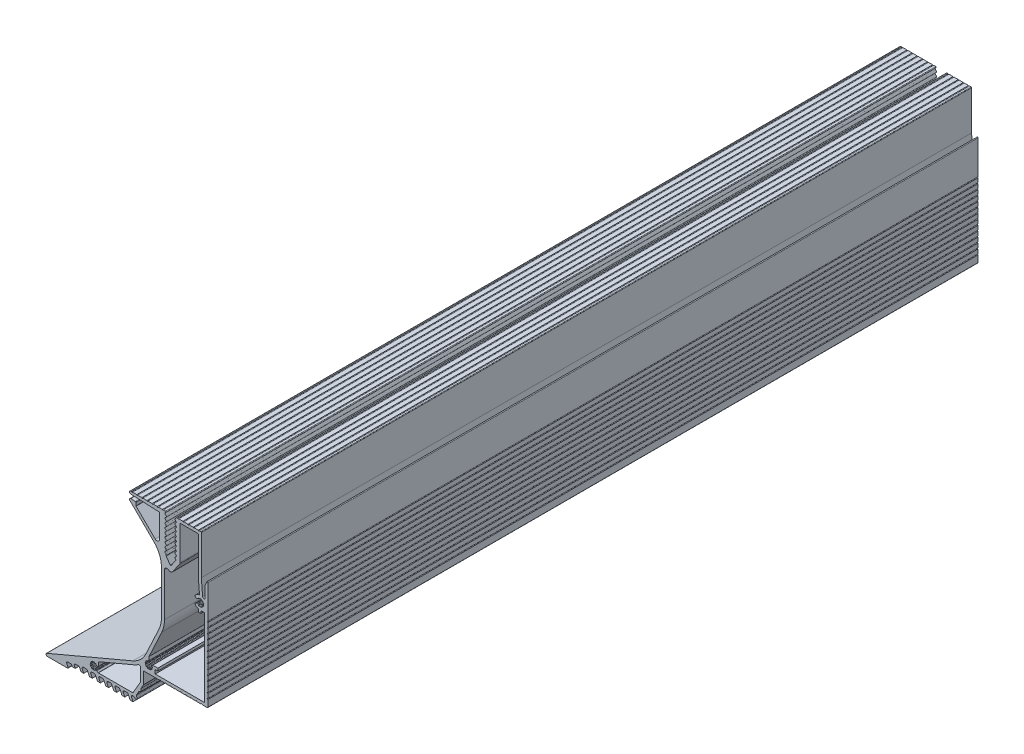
SolidWorks part; units mm, degrees
ref_plane "Спереди" through (0, 0, 0) normal (0, 0, 1) x (1, 0, 0)
ref_plane "Сверху" through (0, 0, 0) normal (0, 1, 0) x (1, 0, 0)
ref_plane "Справа" through (0, 0, 0) normal (1, 0, 0) x (0, 0, -1)
sketch "Model" plane through (0, 0, 0) normal (0, 0, 1) x (1, 0, 0)
  line L0 (291.7679, 401.4517) -> (292.2048, 401.0851)
  line L1 (292.3333, 401.0383) -> (305.4713, 401.0383)
  line L2 (305.9043, 401.2883) -> (308.6544, 406.0516)
  line L3 (308.7214, 406.3016) -> (308.7214, 411.2244)
  line L4 (306.1894, 410.7051) -> (292.5397, 404.9201)
  line L5 (292.4177, 404.736) -> (292.4177, 403.3787)
  line L6 (292.2909, 403.1925) -> (292.0362, 403.0925)
  line L7 (322.8313, 468.657) -> (323.2372, 468.6571)
  line L8 (323.6372, 468.6571) -> (325.2372, 468.6571)
  line L9 (325.6372, 468.6571) -> (327.2372, 468.6571)
  line L10 (327.6372, 468.6571) -> (329.2372, 468.6571)
  line L11 (329.6372, 468.6571) -> (331.2414, 468.6571)
  line L12 (331.6414, 468.6571) -> (332.2214, 468.6571)
  line L13 (332.4214, 468.4571) -> (332.4214, 453.2241)
  line L14 (332.422, 453.2082) -> (332.9091, 447.1178)
  line L15 (333.9214, 447.1582) -> (333.9214, 451.445)
  line L16 (333.939, 451.5271) -> (334.539, 452.8613)
  line L17 (334.9214, 452.7793) -> (334.9214, 439.7379)
  line L18 (334.9214, 439.3379) -> (334.9214, 437.7379)
  line L19 (334.9214, 437.3379) -> (334.9214, 435.7379)
  line L20 (334.9214, 435.3379) -> (334.9214, 433.7379)
  line L21 (334.9214, 433.3379) -> (334.9214, 431.7379)
  line L22 (334.9214, 431.3379) -> (334.9214, 429.7379)
  line L23 (334.9214, 429.3379) -> (334.9214, 427.7379)
  line L24 (334.9214, 427.3379) -> (334.9214, 425.7379)
  line L25 (334.9214, 425.3379) -> (334.9214, 423.7379)
  line L26 (334.9214, 423.3379) -> (334.9214, 421.7379)
  line L27 (334.9214, 421.3379) -> (334.9214, 419.7379)
  line L28 (334.9214, 419.3379) -> (334.9214, 417.7379)
  line L29 (334.9214, 417.3379) -> (334.9214, 415.7379)
  line L30 (334.9214, 415.3379) -> (334.9214, 413.7379)
  line L31 (334.9214, 413.3379) -> (334.9214, 410.7379)
  line L32 (334.7214, 410.5379) -> (332.6414, 410.5379)
  line L33 (332.2414, 410.5379) -> (330.6444, 410.5379)
  line L34 (330.2444, 410.5379) -> (328.6444, 410.5379)
  line L35 (328.2444, 410.5379) -> (326.6444, 410.5379)
  line L36 (326.2444, 410.5379) -> (324.6444, 410.5379)
  line L37 (324.2444, 410.5379) -> (322.6444, 410.5379)
  line L38 (322.2444, 410.5379) -> (320.6444, 410.5379)
  line L39 (320.2444, 410.5379) -> (318.6444, 410.5379)
  line L40 (318.2444, 410.5379) -> (316.6444, 410.5379)
  line L41 (316.2444, 410.5379) -> (310.1214, 410.5379)
  line L42 (309.9214, 410.3379) -> (309.9214, 405.8997)
  line L43 (309.8946, 405.7997) -> (308.8943, 404.0672)
  line L44 (308.0472, 402.5999) -> (307.1909, 401.1168)
  line L45 (307.1708, 400.6555) -> (307.4013, 400.161)
  line L46 (306.495, 399.7384) -> (306.4898, 399.7496)
  line L47 (306.0366, 400.0383) -> (305.6329, 400.0383)
  line L48 (305.1797, 399.327) -> (305.7808, 398.0379)
  line L49 (305.7808, 398.0379) -> (304.6775, 398.0379)
  line L50 (304.6775, 398.0379) -> (303.8793, 399.7496)
  line L51 (303.4261, 400.0383) -> (302.4639, 400.0383)
  line L52 (302.0107, 399.327) -> (302.6118, 398.0379)
  line L53 (302.6118, 398.0379) -> (301.5085, 398.0379)
  line L54 (301.5085, 398.0379) -> (300.7103, 399.7496)
  line L55 (300.2571, 400.0383) -> (299.2949, 400.0383)
  line L56 (298.8417, 399.327) -> (299.4428, 398.0379)
  line L57 (299.4428, 398.0379) -> (298.3395, 398.0379)
  line L58 (298.3395, 398.0379) -> (297.5413, 399.7496)
  line L59 (297.0881, 400.0383) -> (296.1259, 400.0383)
  line L60 (295.6727, 399.327) -> (296.2738, 398.0379)
  line L61 (296.2738, 398.0379) -> (295.1705, 398.0379)
  line L62 (295.1705, 398.0379) -> (294.3723, 399.7496)
  line L63 (293.9191, 400.0383) -> (292.9569, 400.0383)
  line L64 (292.5037, 399.327) -> (293.1048, 398.0379)
  line L65 (293.1048, 398.0379) -> (292.0015, 398.0379)
  line L66 (292.0015, 398.0379) -> (291.2033, 399.7496)
  line L67 (290.7501, 400.0383) -> (289.7879, 400.0383)
  line L68 (289.3347, 399.327) -> (289.9358, 398.0379)
  line L69 (289.9358, 398.0379) -> (288.8325, 398.0379)
  line L70 (288.8325, 398.0379) -> (288.0343, 399.7496)
  line L71 (287.5811, 400.0383) -> (286.4778, 400.0383)
  line L72 (286.0246, 399.327) -> (286.6257, 398.0379)
  line L73 (286.6257, 398.0379) -> (285.5223, 398.0379)
  line L74 (285.5223, 398.0379) -> (284.9521, 399.2608)
  line L75 (284.4989, 399.5495) -> (283.3956, 399.5495)
  line L76 (282.9424, 398.8382) -> (283.3156, 398.0379)
  line L77 (283.3156, 398.0379) -> (282.2122, 398.0379)
  line L78 (282.2122, 398.0379) -> (281.9944, 398.505)
  line L79 (281.5412, 398.7937) -> (280.4379, 398.7937)
  line L80 (279.9847, 398.0824) -> (280.5188, 396.9371)
  line L81 (280.3375, 396.6526) -> (272.4182, 396.6526)
  line L82 (272.223, 397.6129) -> (305.7211, 411.81)
  line L83 (310.882, 416.791) -> (315.9244, 427.6044)
  line L84 (316.8614, 431.8306) -> (316.8614, 449.0475)
  line L85 (313.8784, 456.1723) -> (304.6119, 465.2986)
  line L86 (304.9837, 466.1544) -> (306.7711, 466.0794)
  line L87 (306.9627, 465.8795) -> (306.9627, 464.7513)
  line L88 (307.0224, 464.6088) -> (314.4597, 457.284)
  line L89 (316.1614, 457.9965) -> (316.1614, 466.9947)
  line L90 (315.9697, 467.1945) -> (304.9417, 467.6575)
  line L91 (304.9627, 468.6571) -> (305.2627, 468.6571)
  line L92 (305.6627, 468.6571) -> (307.2627, 468.6571)
  line L93 (307.6627, 468.6571) -> (309.2627, 468.6571)
  line L94 (309.6627, 468.6571) -> (311.2627, 468.6571)
  line L95 (311.6627, 468.6571) -> (313.2627, 468.6571)
  line L96 (313.6627, 468.6571) -> (315.2627, 468.6571)
  line L97 (315.6627, 468.6571) -> (317.2627, 468.6571)
  line L98 (317.6627, 468.6571) -> (318.4659, 468.657)
  line L99 (330.0155, 443.363) -> (330.5869, 443.7048)
  line L100 (330.5617, 445.3302) -> (329.9802, 445.6541)
  line L101 (331.6978, 447.2115) -> (331.2214, 453.1682)
  line L102 (331.2214, 453.1682) -> (331.2214, 467.2571)
  line L103 (331.0214, 467.4571) -> (324.3582, 467.4571)
  line L104 (324.1582, 467.2571) -> (324.1582, 454.1743)
  line L105 (318.0614, 448.6597) -> (318.0614, 431.8306)
  line L106 (317.012, 427.0973) -> (312.0699, 416.499)
  line L107 (312.0512, 416.4145) -> (312.0512, 415.1086)
  line L108 (313.5053, 414.2379) -> (315.4644, 414.2379)
  line L109 (315.4644, 414.2379) -> (315.4644, 413.2379)
  line L110 (315.4644, 413.2379) -> (314.4644, 413.2379)
  line L111 (314.4644, 413.2379) -> (314.4644, 411.7379)
  line L112 (314.4644, 411.7379) -> (333.5214, 411.7379)
  line L113 (333.7214, 411.9379) -> (333.7214, 442.0393)
  line L114 (333.7214, 442.0393) -> (332.2214, 442.0393)
  line L115 (332.2214, 442.0393) -> (332.2214, 441.0393)
  line L116 (332.2214, 441.0393) -> (331.2214, 441.0393)
  line L117 (331.2214, 441.0393) -> (331.2214, 442.0158)
  line L118 (322.5174, 454.1276) -> (320.6225, 451.3942)
  line L119 (318.7365, 453.6405) -> (320.2938, 451.3942)
  line L120 (323.98, 453.6046) -> (321.2004, 449.5949)
  arc A0 (318.7198, 453.8392) -> (318.5126, 454.4383) centre (318.3075, 454.032) ccw
  arc A1 (318.5126, 455.2508) -> (318.5126, 454.4383) centre (318.7177, 454.8445) ccw
  arc A2 (318.5126, 455.2508) -> (318.5126, 456.0633) centre (318.3076, 455.657) ccw
  arc A3 (318.5126, 456.8758) -> (318.5126, 456.0633) centre (318.7177, 456.4695) ccw
  arc A4 (318.5126, 456.8758) -> (318.5126, 457.6883) centre (318.3077, 457.282) ccw
  arc A5 (318.5126, 458.5008) -> (318.5126, 457.6883) centre (318.7177, 458.0945) ccw
  arc A6 (318.5126, 458.5008) -> (318.5126, 459.3133) centre (318.3076, 458.907) ccw
  arc A7 (318.5126, 460.1258) -> (318.5126, 459.3133) centre (318.7177, 459.7195) ccw
  arc A8 (318.5126, 460.1258) -> (318.5126, 460.9383) centre (318.3076, 460.532) ccw
  arc A9 (318.5126, 461.7508) -> (318.5126, 460.9383) centre (318.7177, 461.3445) ccw
  arc A10 (318.5126, 461.7508) -> (318.5126, 462.5633) centre (318.3076, 462.157) ccw
  arc A11 (318.5126, 463.3758) -> (318.5126, 462.5633) centre (318.7177, 462.9695) ccw
  arc A12 (318.5126, 463.3758) -> (318.5126, 464.1883) centre (318.3076, 463.782) ccw
  arc A13 (318.5126, 465.0008) -> (318.5126, 464.1883) centre (318.7177, 464.5945) ccw
  arc A14 (318.5126, 465.0008) -> (318.5126, 465.8133) centre (318.3076, 465.407) ccw
  arc A15 (318.5126, 466.6258) -> (318.5126, 465.8133) centre (318.7177, 466.2195) ccw
  arc A16 (318.5126, 466.6258) -> (318.5126, 467.4383) centre (318.3157, 467.032) ccw
  arc A17 (318.5126, 468.2508) -> (318.5126, 467.4383) centre (318.7174, 467.8445) ccw
  arc A18 (318.5126, 468.2508) -> (318.59, 468.3002) centre (318.3075, 468.657) ccw
  arc A19 (318.59, 468.3002) -> (318.4659, 468.657) centre (318.4686, 468.458) ccw
  arc A20 (322.8313, 468.657) -> (322.6409, 468.5181) centre (322.8311, 468.4574) ccw
  arc A21 (322.4126, 468.2508) -> (322.6409, 468.5181) centre (322.2075, 468.657) ccw
  arc A22 (322.4126, 468.2508) -> (322.4126, 467.4383) centre (322.616, 467.8445) ccw
  arc A23 (322.4126, 466.6258) -> (322.4126, 467.4383) centre (322.2075, 467.032) ccw
  arc A24 (322.4126, 466.6258) -> (322.4126, 465.8133) centre (322.6176, 466.2195) ccw
  arc A25 (322.4126, 465.0008) -> (322.4126, 465.8133) centre (322.2075, 465.407) ccw
  arc A26 (322.4126, 465.0008) -> (322.4126, 464.1883) centre (322.6177, 464.5945) ccw
  arc A27 (322.4126, 463.3758) -> (322.4126, 464.1883) centre (322.2075, 463.782) ccw
  arc A28 (322.4126, 463.3758) -> (322.4126, 462.5633) centre (322.6177, 462.9695) ccw
  arc A29 (322.4126, 461.7508) -> (322.4126, 462.5633) centre (322.2075, 462.157) ccw
  arc A30 (322.4126, 461.7508) -> (322.4126, 460.9383) centre (322.6176, 461.3445) ccw
  arc A31 (322.4126, 460.1258) -> (322.4126, 460.9383) centre (322.2075, 460.532) ccw
  arc A32 (322.4126, 460.1258) -> (322.4126, 459.3133) centre (322.6177, 459.7195) ccw
  arc A33 (322.4126, 458.5008) -> (322.4126, 459.3133) centre (322.2075, 458.907) ccw
  arc A34 (322.4126, 458.5008) -> (322.4126, 457.6883) centre (322.6176, 458.0945) ccw
  arc A35 (322.4126, 456.8758) -> (322.4126, 457.6883) centre (322.2075, 457.282) ccw
  arc A36 (322.4126, 456.8758) -> (322.4126, 456.0633) centre (322.6177, 456.4695) ccw
  arc A37 (322.4126, 455.2508) -> (322.4126, 456.0633) centre (322.2075, 455.657) ccw
  arc A38 (322.4126, 455.2508) -> (322.4126, 454.4383) centre (322.6177, 454.8445) ccw
  arc A39 (322.4671, 454.4058) -> (322.4126, 454.4383) centre (322.2075, 454.032) ccw
  arc A40 (323.2372, 468.6571) -> (323.6372, 468.6571) centre (323.4372, 468.6571) ccw
  arc A41 (325.2372, 468.6571) -> (325.6372, 468.6571) centre (325.4372, 468.6571) ccw
  arc A42 (327.2372, 468.6571) -> (327.6372, 468.6571) centre (327.4372, 468.6571) ccw
  arc A43 (329.2372, 468.6571) -> (329.6372, 468.6571) centre (329.4372, 468.6571) ccw
  arc A44 (331.2414, 468.6571) -> (331.6414, 468.6571) centre (331.4414, 468.6571) ccw
  arc A45 (332.4214, 468.4571) -> (332.2214, 468.6571) centre (332.2214, 468.4571) ccw
  arc A46 (332.4214, 453.2241) -> (332.422, 453.2082) centre (332.6214, 453.2241) ccw
  arc A47 (332.9091, 447.1178) -> (333.9214, 447.1582) centre (333.4152, 447.138) ccw
  arc A48 (333.939, 451.5271) -> (333.9214, 451.445) centre (334.1214, 451.445) ccw
  arc A49 (334.9214, 452.7793) -> (334.539, 452.8613) centre (334.7302, 452.8203) ccw
  arc A50 (334.9214, 439.7379) -> (334.9214, 439.3379) centre (334.9214, 439.5379) ccw
  arc A51 (334.9214, 437.7379) -> (334.9214, 437.3379) centre (334.9214, 437.5379) ccw
  arc A52 (334.9214, 435.7379) -> (334.9214, 435.3379) centre (334.9214, 435.5379) ccw
  arc A53 (334.9214, 433.7379) -> (334.9214, 433.3379) centre (334.9214, 433.5379) ccw
  arc A54 (334.9214, 431.7379) -> (334.9214, 431.3379) centre (334.9214, 431.5379) ccw
  arc A55 (334.9214, 429.7379) -> (334.9214, 429.3379) centre (334.9214, 429.5379) ccw
  arc A56 (334.9214, 427.7379) -> (334.9214, 427.3379) centre (334.9214, 427.5379) ccw
  arc A57 (334.9214, 425.7379) -> (334.9214, 425.3379) centre (334.9214, 425.5379) ccw
  arc A58 (334.9214, 423.7379) -> (334.9214, 423.3379) centre (334.9214, 423.5379) ccw
  arc A59 (334.9214, 421.7379) -> (334.9214, 421.3379) centre (334.9214, 421.5379) ccw
  arc A60 (334.9214, 419.7379) -> (334.9214, 419.3379) centre (334.9214, 419.5379) ccw
  arc A61 (334.9214, 417.7379) -> (334.9214, 417.3379) centre (334.9214, 417.5379) ccw
  arc A62 (334.9214, 415.7379) -> (334.9214, 415.3379) centre (334.9214, 415.5379) ccw
  arc A63 (334.9214, 413.7379) -> (334.9214, 413.3379) centre (334.9214, 413.5379) ccw
  arc A64 (334.7214, 410.5379) -> (334.9214, 410.7379) centre (334.7214, 410.7379) ccw
  arc A65 (332.6414, 410.5379) -> (332.2414, 410.5379) centre (332.4414, 410.5379) ccw
  arc A66 (330.6444, 410.5379) -> (330.2444, 410.5379) centre (330.4444, 410.5379) ccw
  arc A67 (328.6444, 410.5379) -> (328.2444, 410.5379) centre (328.4444, 410.5379) ccw
  arc A68 (326.6444, 410.5379) -> (326.2444, 410.5379) centre (326.4444, 410.5379) ccw
  arc A69 (324.6444, 410.5379) -> (324.2444, 410.5379) centre (324.4444, 410.5379) ccw
  arc A70 (322.6444, 410.5379) -> (322.2444, 410.5379) centre (322.4444, 410.5379) ccw
  arc A71 (320.6444, 410.5379) -> (320.2444, 410.5379) centre (320.4444, 410.5379) ccw
  arc A72 (318.6444, 410.5379) -> (318.2444, 410.5379) centre (318.4444, 410.5379) ccw
  arc A73 (316.6444, 410.5379) -> (316.2444, 410.5379) centre (316.4444, 410.5379) ccw
  arc A74 (310.1214, 410.5379) -> (309.9214, 410.3379) centre (310.1214, 410.3379) ccw
  arc A75 (309.8946, 405.7997) -> (309.9214, 405.8997) centre (309.7214, 405.8997) ccw
  arc A76 (308.8943, 404.0672) -> (308.8854, 403.5832) centre (309.3273, 403.8172) ccw
  arc A77 (308.4619, 402.8496) -> (308.8854, 403.5832) centre (308.4436, 403.3492) ccw
  arc A78 (308.4619, 402.8496) -> (308.0472, 402.5999) centre (308.4802, 402.3499) ccw
  arc A79 (307.1909, 401.1168) -> (307.1708, 400.6555) centre (307.6239, 400.8668) ccw
  arc A80 (306.495, 399.7384) -> (307.4013, 400.161) centre (306.9482, 399.9497) ccw
  arc A81 (306.4898, 399.7496) -> (306.0366, 400.0383) centre (306.0366, 399.5383) ccw
  arc A82 (305.6329, 400.0383) -> (305.1797, 399.327) centre (305.6329, 399.5383) ccw
  arc A83 (303.8793, 399.7496) -> (303.4261, 400.0383) centre (303.4261, 399.5383) ccw
  arc A84 (302.4639, 400.0383) -> (302.0107, 399.327) centre (302.4639, 399.5383) ccw
  arc A85 (300.7103, 399.7496) -> (300.2571, 400.0383) centre (300.2571, 399.5383) ccw
  arc A86 (299.2949, 400.0383) -> (298.8417, 399.327) centre (299.2949, 399.5383) ccw
  arc A87 (297.5413, 399.7496) -> (297.0881, 400.0383) centre (297.0881, 399.5383) ccw
  arc A88 (296.1259, 400.0383) -> (295.6727, 399.327) centre (296.1259, 399.5383) ccw
  arc A89 (294.3723, 399.7496) -> (293.9191, 400.0383) centre (293.9191, 399.5383) ccw
  arc A90 (292.9569, 400.0383) -> (292.5037, 399.327) centre (292.9569, 399.5383) ccw
  arc A91 (291.2033, 399.7496) -> (290.7501, 400.0383) centre (290.7501, 399.5383) ccw
  arc A92 (289.7879, 400.0383) -> (289.3347, 399.327) centre (289.7879, 399.5383) ccw
  arc A93 (288.0343, 399.7496) -> (287.5811, 400.0383) centre (287.5811, 399.5383) ccw
  arc A94 (286.4778, 400.0383) -> (286.0246, 399.327) centre (286.4778, 399.5383) ccw
  arc A95 (284.9521, 399.2608) -> (284.4989, 399.5495) centre (284.4989, 399.0495) ccw
  arc A96 (283.3956, 399.5495) -> (282.9424, 398.8382) centre (283.3956, 399.0495) ccw
  arc A97 (281.9944, 398.505) -> (281.5412, 398.7937) centre (281.5412, 398.2937) ccw
  arc A98 (280.4379, 398.7937) -> (279.9847, 398.0824) centre (280.4379, 398.2937) ccw
  arc A99 (280.3375, 396.6526) -> (280.5188, 396.9371) centre (280.3375, 396.8526) ccw
  arc A100 (272.223, 397.6129) -> (272.4182, 396.6526) centre (272.4182, 397.1526) ccw
  arc A101 (305.7211, 411.81) -> (310.882, 416.791) centre (301.819, 421.0172) ccw
  arc A102 (315.9244, 427.6044) -> (316.8614, 431.8306) centre (306.8614, 431.8306) ccw
  arc A103 (316.8614, 449.0475) -> (313.8784, 456.1723) centre (306.8614, 449.0475) ccw
  arc A104 (304.9837, 466.1544) -> (304.6119, 465.2986) centre (304.9627, 465.6549) ccw
  arc A105 (306.9627, 465.8795) -> (306.7711, 466.0794) centre (306.7627, 465.8795) ccw
  arc A106 (306.9627, 464.7513) -> (307.0224, 464.6088) centre (307.1627, 464.7513) ccw
  arc A107 (304.9627, 468.6571) -> (304.9417, 467.6575) centre (304.9522, 468.1573) ccw
  arc A108 (305.2627, 468.6571) -> (305.6627, 468.6571) centre (305.4627, 468.6571) ccw
  arc A109 (307.2627, 468.6571) -> (307.6627, 468.6571) centre (307.4627, 468.6571) ccw
  arc A110 (309.2627, 468.6571) -> (309.6627, 468.6571) centre (309.4627, 468.6571) ccw
  arc A111 (311.2627, 468.6571) -> (311.6627, 468.6571) centre (311.4627, 468.6571) ccw
  arc A112 (313.2627, 468.6571) -> (313.6627, 468.6571) centre (313.4627, 468.6571) ccw
  arc A113 (315.2627, 468.6571) -> (315.6627, 468.6571) centre (315.4627, 468.6571) ccw
  arc A114 (317.2627, 468.6571) -> (317.6627, 468.6571) centre (317.4627, 468.6571) ccw
  arc A115 (329.9561, 443.0742) -> (331.0925, 442.2027) centre (331.9815, 444.5386) ccw
  arc A116 (330.0155, 443.363) -> (329.9561, 443.0742) centre (330.117, 443.1916) ccw
  arc A117 (330.859, 443.6395) -> (330.5869, 443.7048) centre (330.6896, 443.5331) ccw
  arc A118 (330.859, 443.6395) -> (331.0371, 443.5782) centre (330.9861, 443.7193) ccw
  arc A119 (331.2909, 443.3821) -> (331.0371, 443.5782) centre (331.1017, 443.3995) ccw
  arc A120 (331.2909, 443.3821) -> (331.5477, 443.2634) centre (331.4404, 443.3684) ccw
  arc A121 (331.8614, 443.1969) -> (331.5477, 443.2634) centre (331.6834, 443.1305) ccw
  arc A122 (331.8614, 443.1969) -> (332.1442, 443.2013) centre (332.002, 443.2494) ccw
  arc A123 (332.4557, 443.2776) -> (332.1442, 443.2013) centre (332.3242, 443.1404) ccw
  arc A124 (332.4557, 443.2776) -> (332.7086, 443.4042) centre (332.5596, 443.3859) ccw
  arc A125 (332.9562, 443.6081) -> (332.7086, 443.4042) centre (332.8972, 443.4275) ccw
  arc A126 (332.9562, 443.6081) -> (333.1291, 443.8319) centre (333.0028, 443.7508) ccw
  arc A127 (333.2637, 444.123) -> (333.1291, 443.8319) centre (333.2889, 443.9347) ccw
  arc A128 (333.2637, 444.123) -> (333.3223, 444.3997) centre (333.2438, 444.2718) ccw
  arc A129 (333.3173, 444.7204) -> (333.3223, 444.3997) centre (333.4217, 444.5616) ccw
  arc A130 (333.3173, 444.7204) -> (333.2501, 444.9951) centre (333.2348, 444.8458) ccw
  arc A131 (333.1065, 445.2818) -> (333.2501, 444.9951) centre (333.2694, 445.1841) ccw
  arc A132 (333.1065, 445.2818) -> (332.9267, 445.5002) centre (332.9777, 445.359) ccw
  arc A133 (332.6729, 445.6962) -> (332.9267, 445.5002) centre (332.8621, 445.6789) ccw
  arc A134 (332.6729, 445.6962) -> (332.4161, 445.8149) centre (332.5234, 445.7099) ccw
  arc A135 (332.1024, 445.8814) -> (332.4161, 445.8149) centre (332.2804, 445.9479) ccw
  arc A136 (332.1024, 445.8814) -> (331.8196, 445.877) centre (331.9618, 445.8289) ccw
  arc A137 (331.5081, 445.8008) -> (331.8196, 445.877) centre (331.6396, 445.9379) ccw
  arc A138 (331.5081, 445.8008) -> (331.2552, 445.6741) centre (331.4042, 445.6925) ccw
  arc A139 (331.0076, 445.4703) -> (331.2552, 445.6741) centre (331.0666, 445.6509) ccw
  arc A140 (331.0076, 445.4703) -> (330.8315, 445.4036) centre (330.9609, 445.3276) ccw
  arc A141 (330.5617, 445.3302) -> (330.8315, 445.4036) centre (330.6591, 445.5047) ccw
  arc A142 (329.9119, 445.9409) -> (329.9802, 445.6541) centre (330.0775, 445.8288) ccw
  arc A143 (331.5342, 446.9988) -> (329.9119, 445.9409) centre (331.9819, 444.5392) ccw
  arc A144 (324.3582, 467.4571) -> (324.1582, 467.2571) centre (324.3582, 467.2571) ccw
  arc A145 (319.72, 449.4122) -> (318.0614, 448.6597) centre (319.0614, 448.6597) ccw
  arc A146 (317.012, 427.0973) -> (318.0614, 431.8306) centre (306.8614, 431.8306) ccw
  arc A147 (312.0699, 416.499) -> (312.0512, 416.4145) centre (312.2512, 416.4145) ccw
  arc A148 (311.8338, 414.9094) -> (312.0512, 415.1086) centre (311.8513, 415.1086) ccw
  arc A149 (311.8338, 414.9094) -> (311.6746, 414.7941) centre (311.8207, 414.7599) ccw
  arc A150 (311.3718, 414.6883) -> (311.6746, 414.7941) centre (311.4896, 414.8374) ccw
  arc A151 (311.3718, 414.6883) -> (311.1322, 414.538) centre (311.2788, 414.5705) ccw
  arc A152 (310.9053, 414.3114) -> (311.1322, 414.538) centre (310.9468, 414.4968) ccw
  arc A153 (310.9053, 414.3114) -> (310.7547, 414.072) centre (310.8726, 414.1649) ccw
  arc A154 (310.6486, 413.7693) -> (310.7547, 414.072) centre (310.6055, 413.9544) ccw
  arc A155 (310.6486, 413.7693) -> (310.6168, 413.4883) centre (310.6827, 413.6231) ccw
  arc A156 (310.6525, 413.1696) -> (310.6168, 413.4883) centre (310.5333, 413.3176) ccw
  arc A157 (310.6525, 413.1696) -> (310.7458, 412.9026) centre (310.7466, 413.0527) ccw
  arc A158 (310.9162, 412.6309) -> (310.7458, 412.9026) centre (310.7447, 412.7126) ccw
  arc A159 (310.9162, 412.6309) -> (311.1161, 412.4308) centre (311.0517, 412.5664) ccw
  arc A160 (311.3875, 412.26) -> (311.1161, 412.4308) centre (311.1975, 412.2591) ccw
  arc A161 (311.3875, 412.26) -> (311.6544, 412.1664) centre (311.5376, 412.2607) ccw
  arc A162 (311.9731, 412.1303) -> (311.6544, 412.1664) centre (311.8023, 412.0471) ccw
  arc A163 (311.9731, 412.1303) -> (312.2542, 412.1618) centre (312.108, 412.1961) ccw
  arc A164 (312.557, 412.2676) -> (312.2542, 412.1618) centre (312.4392, 412.1185) ccw
  arc A165 (312.557, 412.2676) -> (312.7965, 412.4179) centre (312.65, 412.3854) ccw
  arc A166 (313.0234, 412.6445) -> (312.7965, 412.4179) centre (312.982, 412.4591) ccw
  arc A167 (313.0234, 412.6445) -> (313.1741, 412.8839) centre (313.0562, 412.791) ccw
  arc A168 (313.2802, 413.1866) -> (313.1741, 412.8839) centre (313.3233, 413.0015) ccw
  arc A169 (313.2802, 413.1866) -> (313.312, 413.4676) centre (313.2462, 413.3327) ccw
  arc A170 (313.2763, 413.7863) -> (313.312, 413.4676) centre (313.3954, 413.6383) ccw
  arc A171 (313.2763, 413.7863) -> (313.3207, 413.961) centre (313.1822, 413.9032) ccw
  arc A172 (322.5174, 454.1276) -> (322.4671, 454.4058) centre (322.353, 454.2415) ccw
  arc A173 (318.7198, 453.8392) -> (318.7365, 453.6405) centre (318.9009, 453.7545) ccw
  arc A174 (320.2938, 451.3942) -> (320.6225, 451.3942) centre (320.4582, 451.5081) ccw
  arc A175 (323.98, 453.6046) -> (324.1582, 454.1743) centre (323.1582, 454.1743) ccw
  arc A176 (319.72, 449.4122) -> (321.2004, 449.5949) centre (320.3786, 450.1646) ccw
  arc A177 (314.4597, 457.284) -> (316.1614, 457.9965) centre (315.1614, 457.9965) ccw
  arc A178 (316.1614, 466.9947) -> (315.9697, 467.1945) centre (315.9614, 466.9947) ccw
  arc A179 (331.2214, 467.2571) -> (331.0214, 467.4571) centre (331.0214, 467.2571) ccw
  arc A180 (331.5342, 446.9988) -> (331.6978, 447.2115) centre (331.4984, 447.1955) ccw
  arc A181 (331.2214, 442.0158) -> (331.0925, 442.2027) centre (331.0214, 442.0158) ccw
  arc A182 (333.5214, 411.7379) -> (333.7214, 411.9379) centre (333.5214, 411.9379) ccw
  arc A183 (313.5053, 414.2379) -> (313.3207, 413.961) centre (313.5053, 414.0379) ccw
  arc A184 (290.1635, 401.1983) -> (290.4426, 401.1521) centre (290.3112, 401.2248) ccw
  arc A185 (290.7627, 401.1716) -> (290.4426, 401.1521) centre (290.6088, 401.0601) ccw
  arc A186 (290.7627, 401.1716) -> (291.0341, 401.2511) centre (290.8843, 401.2595) ccw
  arc A187 (291.3141, 401.4075) -> (291.0341, 401.2511) centre (291.2238, 401.2403) ccw
  arc A188 (291.3141, 401.4075) -> (291.4943, 401.4362) centre (291.3854, 401.5395) ccw
  arc A189 (291.7679, 401.4517) -> (291.4943, 401.4362) centre (291.6393, 401.2985) ccw
  arc A190 (292.2048, 401.0851) -> (292.3333, 401.0383) centre (292.3333, 401.2383) ccw
  arc A191 (305.4713, 401.0383) -> (305.9043, 401.2883) centre (305.4713, 401.5383) ccw
  arc A192 (308.6544, 406.0516) -> (308.7214, 406.3016) centre (308.2214, 406.3016) ccw
  arc A193 (308.7214, 411.2244) -> (307.9478, 411.6429) centre (308.2214, 411.2244) ccw
  arc A194 (306.1894, 410.7051) -> (307.9478, 411.6429) centre (301.819, 421.0172) ccw
  arc A195 (292.5397, 404.9201) -> (292.4177, 404.736) centre (292.6177, 404.736) ccw
  arc A196 (292.2909, 403.1925) -> (292.4177, 403.3787) centre (292.2177, 403.3787) ccw
  arc A197 (291.7829, 403.1917) -> (292.0362, 403.0925) centre (291.963, 403.2786) ccw
  arc A198 (291.7829, 403.1917) -> (291.6227, 403.2745) centre (291.6477, 403.1265) ccw
  arc A199 (291.4079, 403.5126) -> (291.6227, 403.2745) centre (291.591, 403.4618) ccw
  arc A200 (291.4079, 403.5126) -> (291.1765, 403.6753) centre (291.2633, 403.5528) ccw
  arc A201 (290.8797, 403.7967) -> (291.1765, 403.6753) centre (291.0667, 403.8303) ccw
  arc A202 (290.8797, 403.7967) -> (290.6007, 403.8428) centre (290.732, 403.7701) ccw
  arc A203 (290.2811, 403.8226) -> (290.6007, 403.8428) centre (290.4344, 403.9348) ccw
  arc A204 (290.2811, 403.8226) -> (290.0091, 403.7439) centre (290.159, 403.7354) ccw
  arc A205 (289.7291, 403.5875) -> (290.0091, 403.7439) centre (289.8194, 403.7546) ccw
  arc A206 (289.7291, 403.5875) -> (289.5191, 403.3981) centre (289.6578, 403.4554) ccw
  arc A207 (289.3347, 403.1357) -> (289.5191, 403.3981) centre (289.3435, 403.3255) ccw
  arc A208 (289.3347, 403.1357) -> (289.2276, 402.8739) centre (289.3277, 402.9857) ccw
  arc A209 (289.1753, 402.5575) -> (289.2276, 402.8739) centre (289.1009, 402.7323) ccw
  arc A210 (289.1753, 402.5575) -> (289.1924, 402.2752) centre (289.2341, 402.4194) ccw
  arc A211 (289.2826, 401.9674) -> (289.1924, 402.2752) centre (289.1397, 402.0926) ccw
  arc A212 (289.2826, 401.9674) -> (289.4205, 401.7205) centre (289.3955, 401.8685) ccw
  arc A213 (289.6353, 401.4823) -> (289.4205, 401.7205) centre (289.4522, 401.5331) ccw
  arc A214 (289.6353, 401.4823) -> (289.8667, 401.3197) centre (289.7799, 401.4421) ccw
  arc A215 (290.1635, 401.1983) -> (289.8667, 401.3197) centre (289.9765, 401.1646) ccw
extrude "Бобышка-Вытянуть1" add sketch "Model" along normal blind 300
